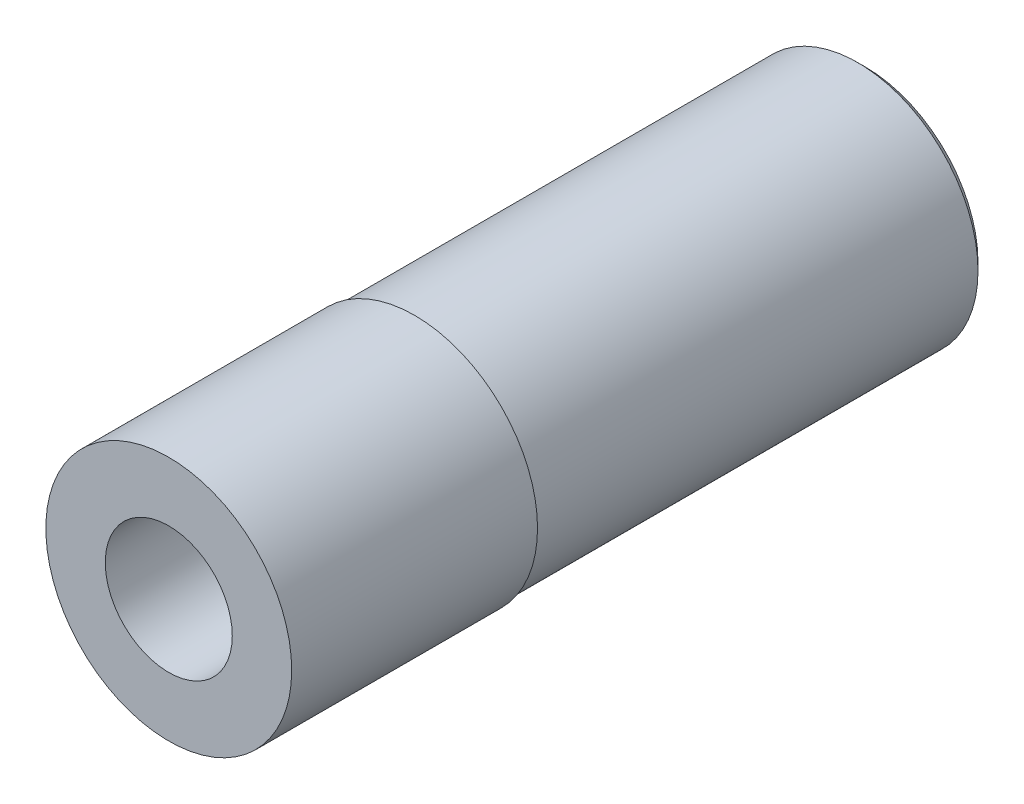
SolidWorks part; units mm, degrees
ref_plane "Front Plane" through (0, 0, 0) normal (0, 0, 1) x (1, 0, 0)
ref_plane "Top Plane" through (0, 0, 0) normal (0, 1, 0) x (1, 0, 0)
ref_plane "Right Plane" through (0, 0, 0) normal (1, 0, 0) x (0, 0, -1)
sketch "Sketch1" plane through (0, 0, 0) normal (1, 0, 0) x (0, 0, -1)
  line L2 (0, 3) -> (0, 1.55)
  line L3 (16.75, 3) -> (0, 3)
  line L4 (-3.7979, 0) -> (49996.2021, 0) construction
  line L8 (14, 0.8) -> (2.8, 0.8)
  line L9 (2.8, 1.55) -> (2.8, 0.8)
  line L10 (2.8, 1.55) -> (0, 1.55)
  line L12 (17, 1.5) -> (17, 2.75)
  line L16 (17, 2.75) -> (16.75, 3)
  line L17 (17, 1.5) -> (14, 1.5)
  line L18 (14, 0.8) -> (14, 1.5)
  dimension "D1" = 17
  dimension "D2" = 45
  dimension "D3" = 0.25
  dimension "D4" = 6
  dimension "D5" = 3.1
  dimension "D6" = 2.8
  dimension "D7" = 1.6
  dimension "D8" = 3
  dimension "D9" = 3
revolve "Revolve1" add sketch "Sketch1" angle 360 about L4
sketch "Sketch4" plane through (0, 0, 0) normal (1, 0, 0) x (0, 0, -1)
  line L0 (0, 0) -> (50000, 0) construction
  line L1 (17, -2.75) -> (17, 2.75) construction
  line L2 (6, 3.935) -> (17, 3.935)
  line L3 (6, 3.935) -> (6, 2.935)
  line L4 (6, 2.935) -> (17, 2.935)
  line L5 (17, 3.935) -> (17, 2.935)
  line L6 (16.75, 3) -> (0, 3) construction
  line L9 (0, 3.3) -> (0, -3.3) construction
  dimension "D1" = 1
  dimension "D2" = 0.065
  dimension "D3" = 6
revolve "Cut-Revolve1" cut sketch "Sketch4" angle 360 about L0
sketch "Sketch3" plane through (0, 0, -2.8) normal (0, 0, 1) x (1, 0, 0)
  line L0 (0, 0) -> (0, 50000) construction
  line L1 (0.4619, 0.8) -> (-0.4619, 0.8)
  line L2 (-0.4619, 0.8) -> (-0.9238, 0)
  line L3 (-0.9238, 0) -> (-0.4619, -0.8)
  line L4 (-0.4619, -0.8) -> (0.4619, -0.8)
  line L5 (0.4619, -0.8) -> (0.9238, 0)
  line L6 (0.9238, 0) -> (0.4619, 0.8)
  line L7 (0, 0) -> (50000, 0) construction
  circle A0 centre (0, 0) radius 0.8 construction
  circle A1 centre (0, 0) radius 0.8 construction
extrude "Cut-Extrude2" cut sketch "Sketch3" against normal blind 1.4
